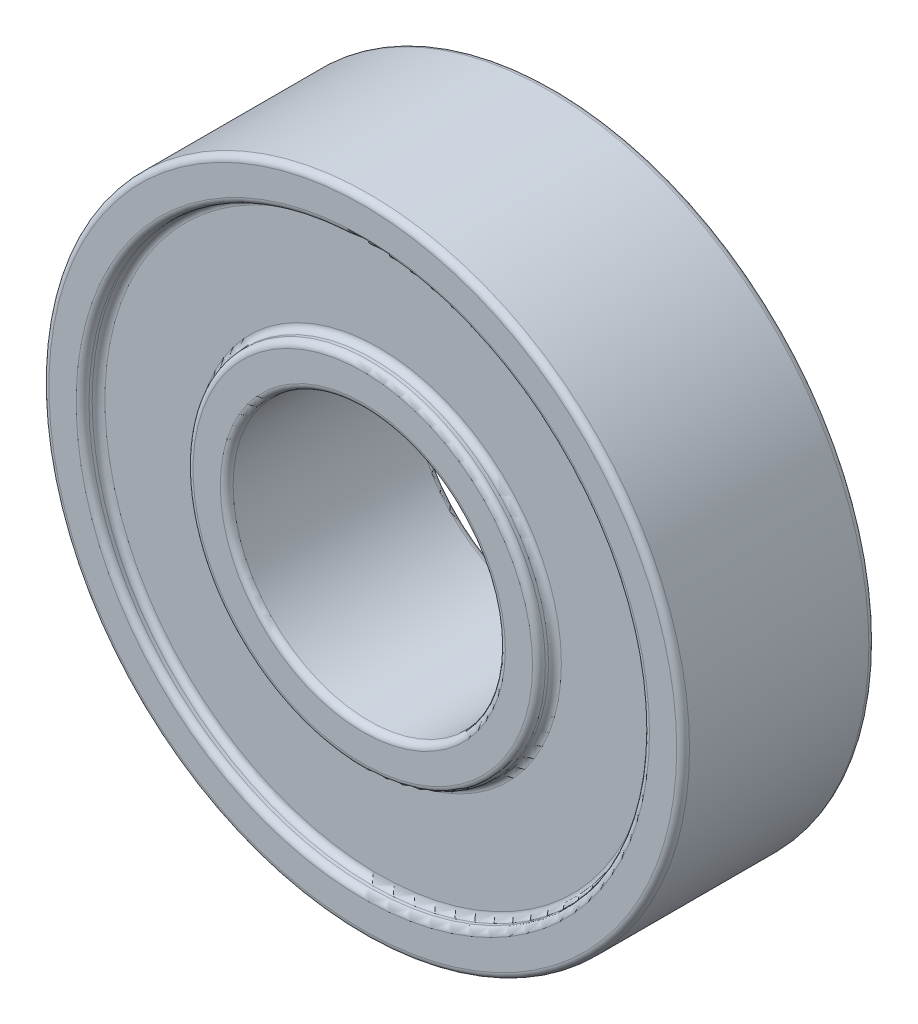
SolidWorks part; units mm, degrees
ref_plane "Plan1" through (0, 0, 0) normal (0, 0, 1) x (1, 0, 0)
ref_plane "Plan2" through (0, 0, 0) normal (0, 1, 0) x (1, 0, 0)
ref_plane "Plan3" through (0, 0, 0) normal (1, 0, 0) x (0, 0, -1)
sketch "Esquisse1" plane through (0, 0, 0) normal (0, 0, 1) x (1, 0, 0)
  circle A0 centre (0, 0) radius 8.5
  circle A1 centre (0, 0) radius 20
  dimension "D1" = 17
  dimension "D2" = 40
extrude "Base-Extrusion" add sketch "Esquisse1" along normal blind 12
sketch "Esquisse2" plane through (0, 0, 12) normal (0, 0, 1) x (1, 0, 0)
  circle A0 centre (0, 0) radius 17.5
  circle A1 centre (0, 0) radius 11
  dimension "D1" = 35
  dimension "D2" = 22
extrude "Enlèv. mat.-Extru.1" cut sketch "Esquisse2" against normal blind 1
sketch "Esquisse4" plane through (0, 0, 0) normal (0, 0, -1) x (-1, 0, 0)
  circle A0 centre (-0.1188, 0.1783) radius 11
  circle A1 centre (0, 0) radius 17.5
  dimension "D1" = 22
  dimension "D2" = 35
extrude "Enlèv. mat.-Extru.2" cut sketch "Esquisse4" against normal blind 1
fillet "Congé1" radius 0.4
